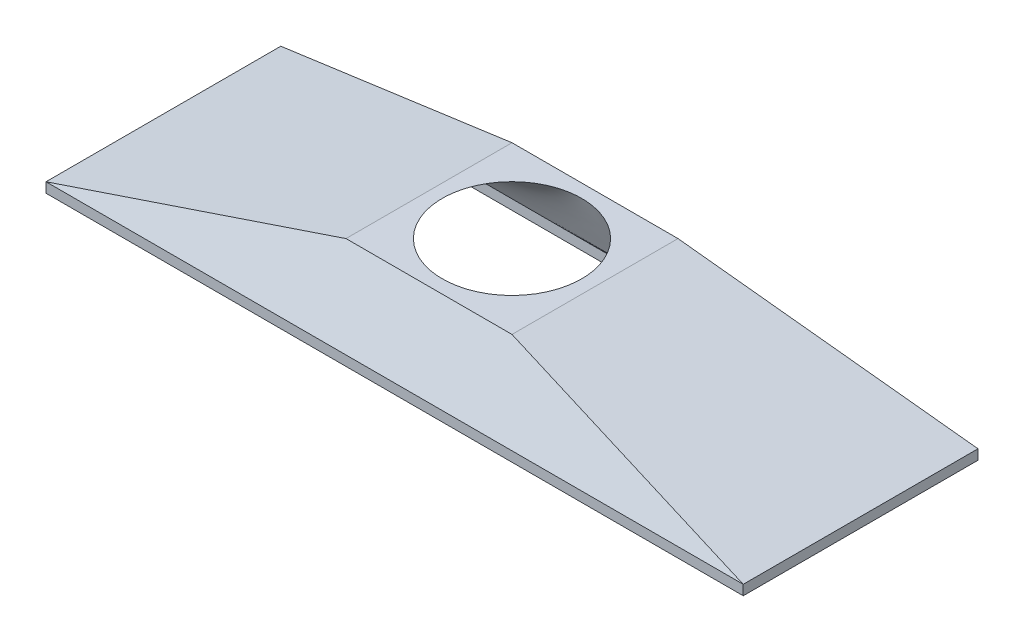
SolidWorks part; units mm, degrees
ref_plane "Front" through (0, 0, 0) normal (0, 0, 1) x (1, 0, 0)
ref_plane "Top" through (0, 0, 0) normal (0, 1, 0) x (1, 0, 0)
ref_plane "Right" through (0, 0, 0) normal (1, 0, 0) x (0, 0, -1)
sketch "草图1" plane through (0, 0, 0) normal (0, 1, 0) x (1, 0, 0)
  line L1 (-105, -35.355) -> (105, -35.355)
  line L2 (-105, -35.355) -> (-105, 35.355)
  line L3 (-105, 35.355) -> (105, 35.355)
  line L4 (105, -35.355) -> (105, 35.355)
  point P0 (0, 0)
  point P6 (0, 0)
  dimension "D1" = 210
  dimension "D2" = 70.71
  dimension "D3" = 35.355
  dimension "D4" = 105
ref_plane "基准面1" through (0, 20, 0) normal (0, 1, 0) x (1, 0, 0)
sketch "草图3" plane through (0, 20, 0) normal (0, 1, 0) x (1, 0, 0)
  line L1 (-25, -25) -> (25, -25)
  line L2 (-25, -25) -> (-25, 25)
  line L3 (-25, 25) -> (25, 25)
  line L4 (25, -25) -> (25, 25)
  point P0 (0, 0)
  dimension "D3" = 25
  dimension "D1" = 50
  dimension "D2" = 50
  dimension "D4" = 25
loft "放样2" add profiles "草图3", "草图1"
sketch "草图4" plane through (0, 20, 0) normal (0, 1, 0) x (1, 0, 0)
  circle A0 centre (0, 0) radius 21
  dimension "D1" = 42
sketch "草图5" plane through (0, 0, 0) normal (0, -1, 0) x (1, 0, 0)
  line L0 (105, -35.355) -> (-105, -35.355) construction
  line L1 (100, 30.355) -> (-100, 30.355)
  line L2 (100, 30.355) -> (100, -30.355)
  line L3 (100, -30.355) -> (-100, -30.355)
  line L4 (-100, 30.355) -> (-100, -30.355)
  line L5 (100, 30.355) -> (-100, -30.355) construction
  line L6 (100, -30.355) -> (-100, 30.355) construction
  line L7 (-105, -35.355) -> (-105, 35.355) construction
  point P0 (0, 0)
  dimension "D1" = 5
  dimension "D2" = 5
loft "切除-放样1" cut profiles "草图4", "草图5"
sketch "草图6" plane through (0, 0, 0) normal (0, -1, 0) x (1, 0, 0)
  line L1 (105, -35.355) -> (-105, -35.355)
  line L2 (105, -35.355) -> (105, 35.355)
  line L3 (105, 35.355) -> (-105, 35.355)
  line L4 (-105, -35.355) -> (-105, 35.355)
  line L5 (100, -30.355) -> (-100, -30.355)
  line L6 (100, -30.355) -> (100, 30.355)
  line L7 (100, 30.355) -> (-100, 30.355)
  line L8 (-100, -30.355) -> (-100, 30.355)
extrude "凸台-拉伸1" add sketch "草图6" along normal blind 3
